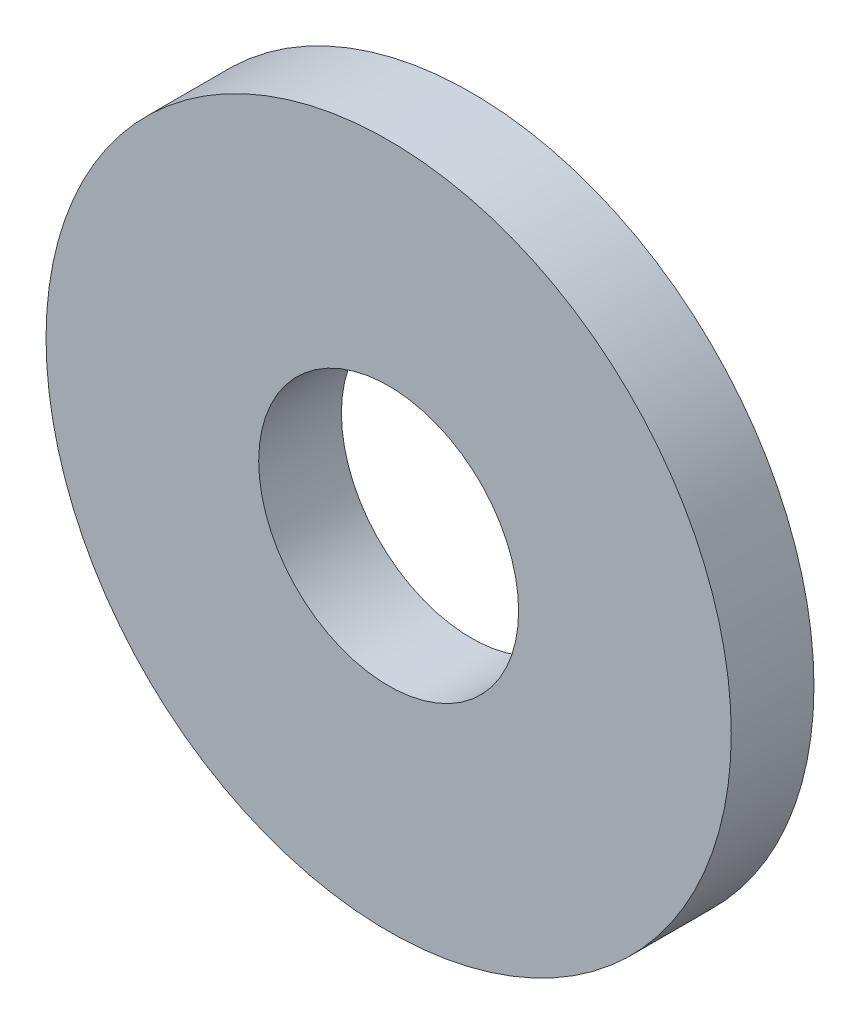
SolidWorks part; units mm, degrees
ref_plane "Face" through (0, 0, 0) normal (0, 0, 1) x (1, 0, 0)
ref_plane "Dessus" through (0, 0, 0) normal (0, 1, 0) x (1, 0, 0)
ref_plane "Côté" through (0, 0, 0) normal (1, 0, 0) x (0, 0, -1)
sketch "Esquisse1" plane through (0, 0, 0) normal (0, 0, 1) x (1, 0, 0)
  circle A0 centre (0, 0) radius 1.1
  circle A1 centre (0, 0) radius 2.9
  dimension "Ø Int." = 2.2
  dimension "Ø Ext." = 5.8
extrude "Base-Extrusion" add sketch "Esquisse1" along normal blind 0.7
other "Bloquer***"
